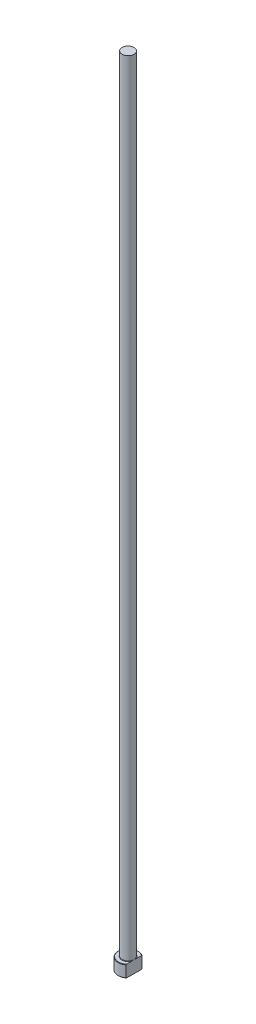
SolidWorks part; units mm, degrees
ref_plane "Front Plane" through (0, 0, 0) normal (0, 0, 1) x (1, 0, 0)
ref_plane "Top Plane" through (0, 0, 0) normal (0, 1, 0) x (1, 0, 0)
ref_plane "Right Plane" through (0, 0, 0) normal (1, 0, 0) x (0, 0, -1)
sketch "Sketch1" plane through (0, 0, 0) normal (0, 0, 1) x (1, 0, 0)
  line L0 (0, 259.9588) -> (0, -15.1925) construction
  line L1 (0, 0) -> (-5, 0)
  line L2 (-5, 0) -> (-5, 6)
  line L3 (-5, 6) -> (-3, 6)
  line L4 (-3, 6) -> (-3, 400)
  line L5 (-3, 400) -> (0, 400)
  line L6 (0, 400) -> (0, 0)
  dimension "L" = 400
  dimension "H" = 10
  dimension "T" = 6
  dimension "D" = 6
revolve "Revolve1" add sketch "Sketch1" angle 360 about L0
chamfer "Chamfer1" distance 0.2 angle 45 2 edges at (0, 6, 5) (0, 0, 5)
fillet "Fillet1" radius 0.2 1 edges at (0, 6, 3)
sketch "Sketch2" plane through (0, 0, 0) normal (0, 1, 0) x (1, 0, 0)
  line L0 (3, -4) -> (3, 4)
  circle A0 centre (0, 0) radius 5 construction
  arc A1 (3, -4) -> (3, 4) centre (0, 0) ccw
  circle A2 centre (0, 0) radius 3 construction
extrude "KEYED HEAD" cut sketch "Sketch2" along normal through all
